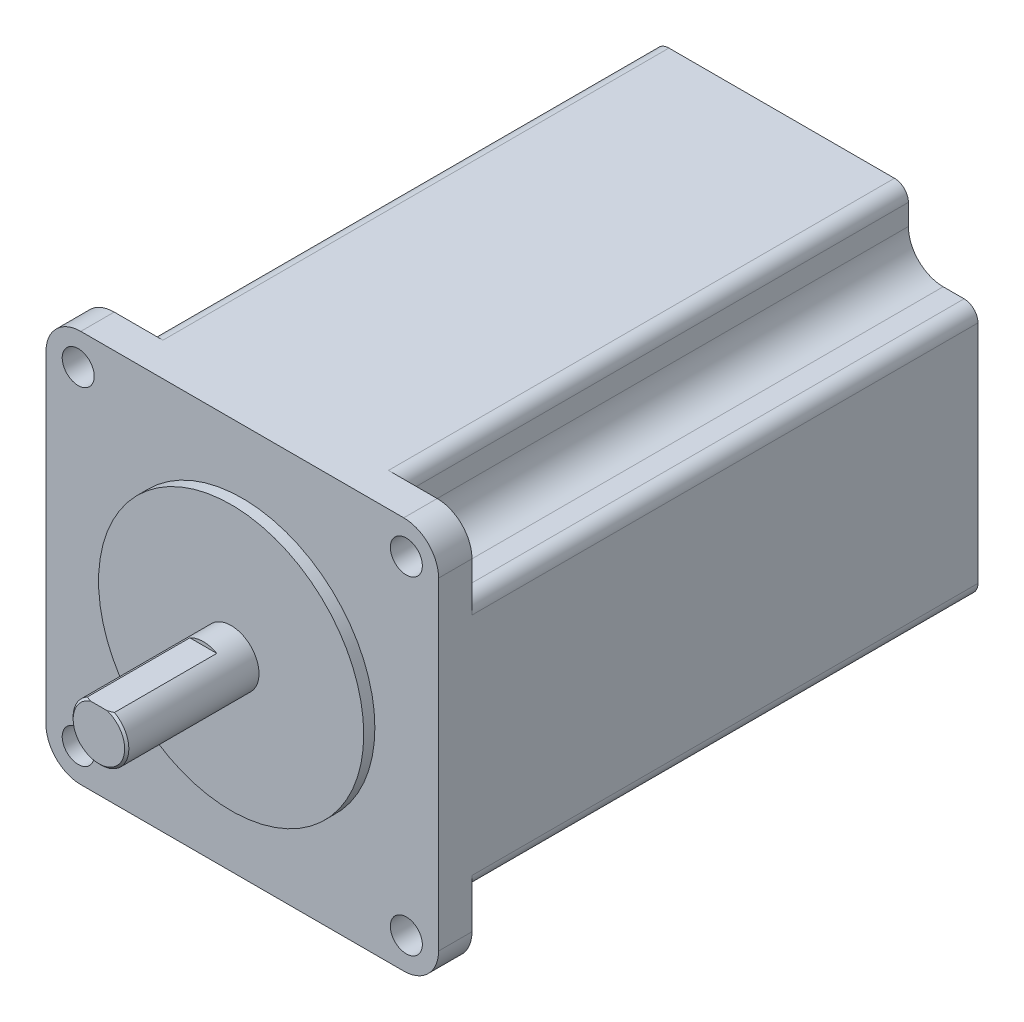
SolidWorks part; units mm, degrees
ref_plane "前视基准面" through (0, 0, 0) normal (0, 0, 1) x (1, 0, 0)
ref_plane "上视基准面" through (0, 0, 0) normal (0, 1, 0) x (1, 0, 0)
ref_plane "右视基准面" through (0, 0, 0) normal (1, 0, 0) x (0, 0, -1)
sketch "草图1" plane through (0, 0, 0) normal (0, 0, 1) x (1, 0, 0)
  circle A0 centre (0, 0) radius 19.05
extrude "凸台-拉伸1" add sketch "草图1" against normal blind 1.6
sketch "草图2" plane through (0, 0, 0) normal (0, 0, 1) x (1, 0, 0)
  circle A0 centre (0, 0) radius 4
extrude "凸台-拉伸2" add sketch "草图2" along normal blind 19
sketch "草图3" plane through (0, 0, 19) normal (0, 0, 1) x (1, 0, 0)
  line L2 (-1.9365, 3.5) -> (1.9365, 3.5)
  circle A1 centre (0, 0) radius 4 construction
  arc A2 (1.9365, 3.5) -> (-1.9365, 3.5) centre (0, 0) ccw
extrude "切除-拉伸1" cut sketch "草图3" against normal blind 15
sketch "草图4" plane through (0, 0, -1.6) normal (0, 0, -1) x (-1, 0, 0)
  line L1 (0, 28.2) -> (23.2, 28.2)
  line L2 (28.2, 23.2) -> (28.2, -23.2)
  line L3 (23.2, -28.2) -> (-23.2, -28.2)
  line L4 (-28.2, -23.2) -> (-28.2, 23.2)
  line L5 (-23.2, 28.2) -> (0, 28.2)
  arc A0 (-23.2, -28.2) -> (-28.2, -23.2) centre (-23.2, -23.2) cw
  arc A1 (28.2, -23.2) -> (23.2, -28.2) centre (23.2, -23.2) cw
  arc A2 (23.2, 28.2) -> (28.2, 23.2) centre (23.2, 23.2) cw
  arc A3 (-28.2, 23.2) -> (-23.2, 28.2) centre (-23.2, 23.2) cw
  dimension "D1" = 5
extrude "凸台-拉伸3" add sketch "草图4" along normal blind 77.5
sketch "草图5" plane through (0, 0, -79.1) normal (0, 0, -1) x (-1, 0, 0)
  line L1 (23.2, 28.2) -> (-23.2, 28.2) construction
  line L2 (11.4944, 28.2) -> (16.2, 28.2)
  line L3 (18.2, 26.2) -> (18.2, 23.2)
  line L4 (23.2, 18.2) -> (26.2, 18.2)
  line L5 (28.2, -23.2) -> (28.2, 23.2) construction
  line L6 (28.2, 16.2) -> (28.2, 9.9204)
  line L7 (28.2, 9.9204) -> (36.4601, 9.9204)
  line L8 (36.4601, 9.9204) -> (36.4601, 32.1771)
  line L9 (36.4601, 32.1771) -> (11.4944, 32.1771)
  line L10 (11.4944, 32.1771) -> (11.4944, 28.2)
  line L12 (-11.4944, 32.1771) -> (-11.4944, 28.2)
  line L13 (-36.4601, 32.1771) -> (-11.4944, 32.1771)
  line L14 (-36.4601, 9.9204) -> (-36.4601, 32.1771)
  line L15 (-28.2, 9.9204) -> (-36.4601, 9.9204)
  line L16 (-28.2, 16.2) -> (-28.2, 9.9204)
  line L17 (-23.2, 18.2) -> (-26.2, 18.2)
  line L18 (-18.2, 26.2) -> (-18.2, 23.2)
  line L19 (-11.4944, 28.2) -> (-16.2, 28.2)
  line L20 (11.4944, -32.1771) -> (11.4944, -28.2)
  line L21 (36.4601, -32.1771) -> (11.4944, -32.1771)
  line L22 (36.4601, -9.9204) -> (36.4601, -32.1771)
  line L23 (28.2, -9.9204) -> (36.4601, -9.9204)
  line L24 (28.2, -16.2) -> (28.2, -9.9204)
  line L25 (23.2, -18.2) -> (26.2, -18.2)
  line L26 (18.2, -26.2) -> (18.2, -23.2)
  line L27 (11.4944, -28.2) -> (16.2, -28.2)
  line L28 (-11.4944, -28.2) -> (-16.2, -28.2)
  line L29 (-18.2, -26.2) -> (-18.2, -23.2)
  line L30 (-23.2, -18.2) -> (-26.2, -18.2)
  line L31 (-28.2, -16.2) -> (-28.2, -9.9204)
  line L32 (-28.2, -9.9204) -> (-36.4601, -9.9204)
  line L33 (-36.4601, -9.9204) -> (-36.4601, -32.1771)
  line L34 (-36.4601, -32.1771) -> (-11.4944, -32.1771)
  line L35 (-11.4944, -32.1771) -> (-11.4944, -28.2)
  arc A0 (18.2, 23.2) -> (23.2, 18.2) centre (23.2, 23.2) ccw
  arc A1 (26.2, 18.2) -> (28.2, 16.2) centre (26.2, 16.2) cw
  arc A2 (16.2, 28.2) -> (18.2, 26.2) centre (16.2, 26.2) cw
  arc A3 (-16.2, 28.2) -> (-18.2, 26.2) centre (-16.2, 26.2) ccw
  arc A4 (-26.2, 18.2) -> (-28.2, 16.2) centre (-26.2, 16.2) ccw
  arc A5 (-18.2, 23.2) -> (-23.2, 18.2) centre (-23.2, 23.2) cw
  arc A6 (16.2, -28.2) -> (18.2, -26.2) centre (16.2, -26.2) ccw
  arc A7 (26.2, -18.2) -> (28.2, -16.2) centre (26.2, -16.2) ccw
  arc A8 (18.2, -23.2) -> (23.2, -18.2) centre (23.2, -23.2) cw
  arc A9 (-18.2, -23.2) -> (-23.2, -18.2) centre (-23.2, -23.2) ccw
  arc A10 (-26.2, -18.2) -> (-28.2, -16.2) centre (-26.2, -16.2) cw
  arc A11 (-16.2, -28.2) -> (-18.2, -26.2) centre (-16.2, -26.2) cw
  point P20 (28.2, 18.2)
  point P23 (18.2, 28.2)
  point P38 (-18.2, 28.2)
  point P39 (-28.2, 18.2)
  point P54 (18.2, -28.2)
  point P55 (28.2, -18.2)
  point P70 (-28.2, -18.2)
  point P71 (-18.2, -28.2)
  dimension "D1" = 5
  dimension "D2" = 2
extrude "切除-拉伸2" cut sketch "草图5" against normal blind 72.7
sketch "草图6" plane through (0, 0, -1.6) normal (0, 0, 1) x (1, 0, 0)
  circle A0 centre (-23.57, 23.57) radius 2.3
  circle A1 centre (23.57, 23.57) radius 2.3
  circle A2 centre (23.57, -23.57) radius 2.3
  circle A3 centre (-23.57, -23.57) radius 2.3
extrude "切除-拉伸3" cut sketch "草图6" against normal blind 49.7
chamfer "倒角1" distance 0.3 angle 45 1 edges at (0, -4, 19)
